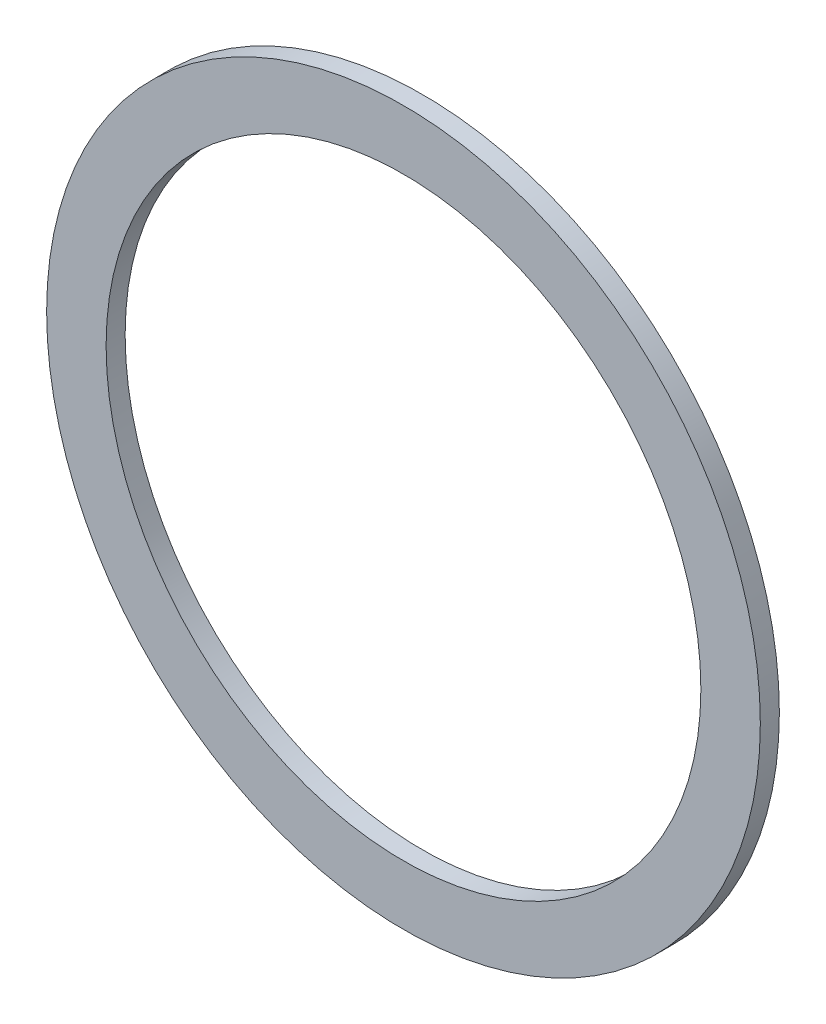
SolidWorks part; units mm, degrees
ref_plane "Plan de face" through (0, 0, 0) normal (0, 0, 1) x (1, 0, 0)
ref_plane "Plan de dessus" through (0, 0, 0) normal (0, 1, 0) x (1, 0, 0)
ref_plane "Plan de droite" through (0, 0, 0) normal (1, 0, 0) x (0, 0, -1)
sketch "Esquisse1" plane through (0, 0, 0) normal (0, 0, 1) x (1, 0, 0)
  circle A0 centre (0, 0) radius 15
  circle A1 centre (0, 0) radius 12.5
extrude "Boss.-Extru.1" add sketch "Esquisse1" along normal blind 0.8
